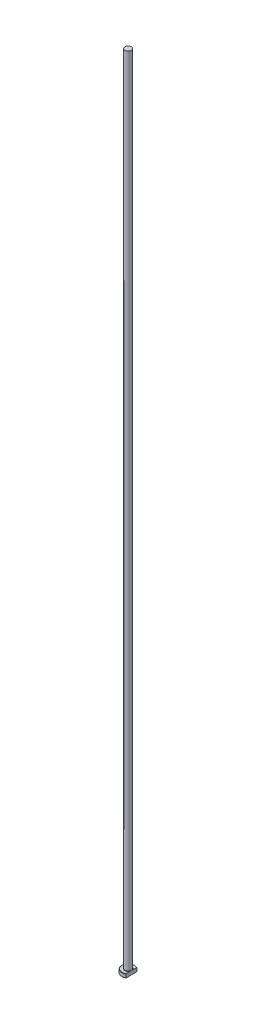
SolidWorks part; units mm, degrees
ref_plane "Front Plane" through (0, 0, 0) normal (0, 0, 1) x (1, 0, 0)
ref_plane "Top Plane" through (0, 0, 0) normal (0, 1, 0) x (1, 0, 0)
ref_plane "Right Plane" through (0, 0, 0) normal (1, 0, 0) x (0, 0, -1)
sketch "Sketch1" plane through (0, 0, 0) normal (0, 0, 1) x (1, 0, 0)
  line L0 (0, 259.9588) -> (0, -15.1925) construction
  line L1 (0, 0) -> (-5, 0)
  line L2 (-5, 0) -> (-5, 3)
  line L3 (-5, 3) -> (-2.5, 3)
  line L4 (-2.5, 3) -> (-2.5, 630)
  line L5 (-2.5, 630) -> (0, 630)
  line L6 (0, 630) -> (0, 0)
  dimension "L" = 630
  dimension "H" = 10
  dimension "T" = 3
  dimension "D" = 5
revolve "Revolve1" add sketch "Sketch1" angle 360 about L0
chamfer "Chamfer1" distance 0.2 angle 45 2 edges at (0, 3, 5) (0, 0, 5)
fillet "Fillet1" radius 0.2 1 edges at (0, 3, 2.5)
sketch "Sketch2" plane through (0, 0, 0) normal (0, 1, 0) x (1, 0, 0)
  line L0 (2.5, 4.3301) -> (2.5, -4.3301)
  circle A0 centre (0, 0) radius 5 construction
  arc A1 (2.5, -4.3301) -> (2.5, 4.3301) centre (0, 0) ccw
  circle A2 centre (0, 0) radius 2.5 construction
extrude "KEY" cut sketch "Sketch2" along normal through all
